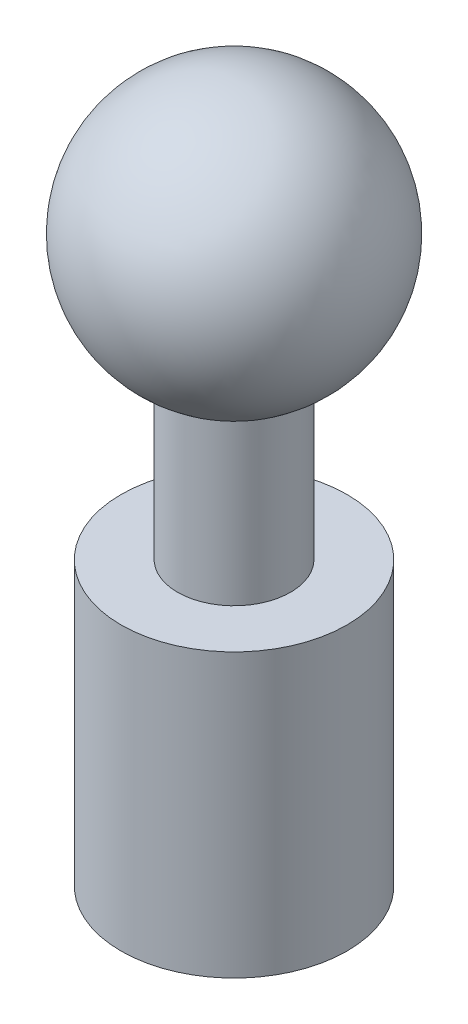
SolidWorks part; units mm, degrees
ref_plane "Front Plane" through (0, 0, 0) normal (0, 0, 1) x (1, 0, 0)
ref_plane "Top Plane" through (0, 0, 0) normal (0, 1, 0) x (1, 0, 0)
ref_plane "Right Plane" through (0, 0, 0) normal (1, 0, 0) x (0, 0, -1)
sketch "Sketch1" plane through (0, 0, 0) normal (0, 1, 0) x (1, 0, 0)
  circle A0 centre (0, 0) radius 2
  dimension "D1" = 4
extrude "Boss-Extrude1" add sketch "Sketch1" along normal blind 5
sketch "Sketch4" plane through (0, 5, 0) normal (0, 1, 0) x (1, 0, 0)
  circle A0 centre (0, 0) radius 1
  dimension "D1" = 2
extrude "Boss-Extrude2" add sketch "Sketch4" along normal blind 3 contours A0
sketch "Sketch2" plane through (0, 0, 0) normal (1, 0, 0) x (0, 0, -1)
  line L1 (0, 0) -> (0, 2.447) construction
  line L2 (0, 12.3487) -> (0, 7.6487)
  arc A0 (0, 7.6487) -> (0, 12.3487) centre (0, 9.9987) ccw
  arc A1 (0, 12.3487) -> (0, 7.6487) centre (0, 9.9987) ccw construction
  dimension "D1" = 4.7
revolve "Revolve12" add sketch "Sketch2" angle 360 about L1
sketch "Sketch3" plane through (0, 0, 0) normal (0, -1, 0) x (1, 0, 0)
  circle A0 centre (0, 0) radius 1.13
  dimension "D1" = 2.26
extrude "Cut-Extrude1" cut sketch "Sketch3" against normal blind 3.5
thread "Thread1" pitch 0.635 start angle 0, offset 0, length 0, pitch 0.635, diameter 2.26
ref_plane "Plane1" through (1.13, 0, 0) normal (0, 0, 1) x (1, 0, 0)
sketch "Thread Profile1" plane through (1.13, 0, 0) normal (0, 0, 1) x (1, 0, 0)
  line L0 (0, 0) -> (0, 0.635) construction
  line L11 (0, 0) -> (0, 0.5556)
  line L12 (0, 0.5556) -> (-0.3437, 0.3572)
  line L13 (-0.3437, 0.3572) -> (-0.3437, 0.1984)
  line L15 (-0.3437, 0.1984) -> (0, 0)
  line L17 (-0.3437, 0.2778) -> (0, 0.2778) construction
  point P2 (0, 0)
  dimension "Pitch" = 0.635
  dimension "Profile_Angle" = 60
  dimension "Profile_Land" = 0.1588
  dimension "Profile_Height" = 0.3437
